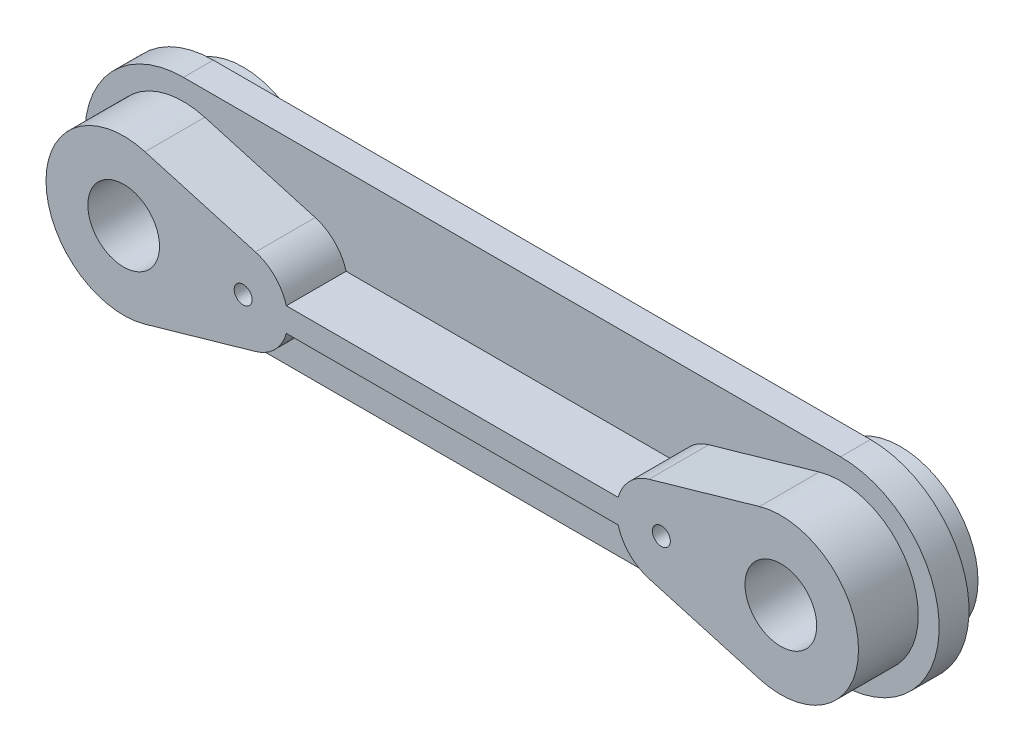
SolidWorks part; units mm, degrees
ref_plane "前视基准面" through (0, 0, 0) normal (0, 0, 1) x (1, 0, 0)
ref_plane "上视基准面" through (0, 0, 0) normal (0, 1, 0) x (1, 0, 0)
ref_plane "右视基准面" through (0, 0, 0) normal (1, 0, 0) x (0, 0, -1)
sketch "草图1" plane through (0, 0, 0) normal (0, 0, 1) x (1, 0, 0)
  line L0 (0, 0) -> (237.8878, 0) construction
  line L1 (0, 33) -> (220, 33)
  line L2 (0, -33) -> (220, -33)
  arc A0 (0, 33) -> (0, -33) centre (0, 0) ccw
  arc A1 (220, -33) -> (220, 33) centre (220, 0) ccw
  dimension "D1" = 66
  dimension "D2" = 66
  dimension "D3" = 220
extrude "拉伸1" add sketch "草图1" along normal blind 10
sketch "草图2" plane through (0, 0, 10) normal (0, 0, 1) x (1, 0, 0)
  line L0 (0, 0) -> (220, 0) construction
  line L1 (44.125, 14.4217) -> (7.15, 24.9975)
  line L2 (7.15, -24.9975) -> (44.125, -14.4217)
  line L3 (175.875, 14.4217) -> (212.85, 24.9975)
  line L4 (175.875, -14.4217) -> (212.85, -24.9975)
  line L5 (54.4568, 4) -> (165.5432, 4)
  line L6 (54.4568, -4) -> (165.5432, -4)
  arc A0 (165.5432, -4) -> (175.875, -14.4217) centre (180, 0) ccw
  arc A1 (212.85, -24.9975) -> (212.85, 24.9975) centre (220, 0) ccw
  arc A2 (44.125, -14.4217) -> (54.4568, -4) centre (40, 0) ccw
  arc A3 (54.4568, 4) -> (44.125, 14.4217) centre (40, 0) ccw
  arc A4 (175.875, 14.4217) -> (165.5432, 4) centre (180, 0) ccw
  arc A5 (7.15, 24.9975) -> (7.15, -24.9975) centre (0, 0) ccw
  dimension "D1" = 26
  dimension "D2" = 30
  dimension "D3" = 40
  dimension "D4" = 52
  dimension "D5" = 15
  dimension "D6" = 40
  dimension "D7" = 8
  dimension "D8" = 4
extrude "拉伸2" add sketch "草图2" along normal blind 20
sketch "草图3" plane through (0, 0, 0) normal (0, 0, -1) x (-1, 0, 0)
  circle A0 centre (-220, 0) radius 26
  circle A1 centre (0, 0) radius 26
  dimension "D1" = 52
  dimension "D2" = 52
extrude "拉伸3" add sketch "草图3" along normal blind 10
sketch "草图4" plane through (0, 0, 30) normal (0, 0, 1) x (1, 0, 0)
  circle A0 centre (0, 0) radius 12
  circle A1 centre (40, 0) radius 3
  circle A2 centre (220, 0) radius 12
  circle A3 centre (180, 0) radius 3
  dimension "D1" = 24
  dimension "D2" = 6
  dimension "D3" = 6
  dimension "D4" = 24
extrude "切除-拉伸1" cut sketch "草图4" against normal through all
